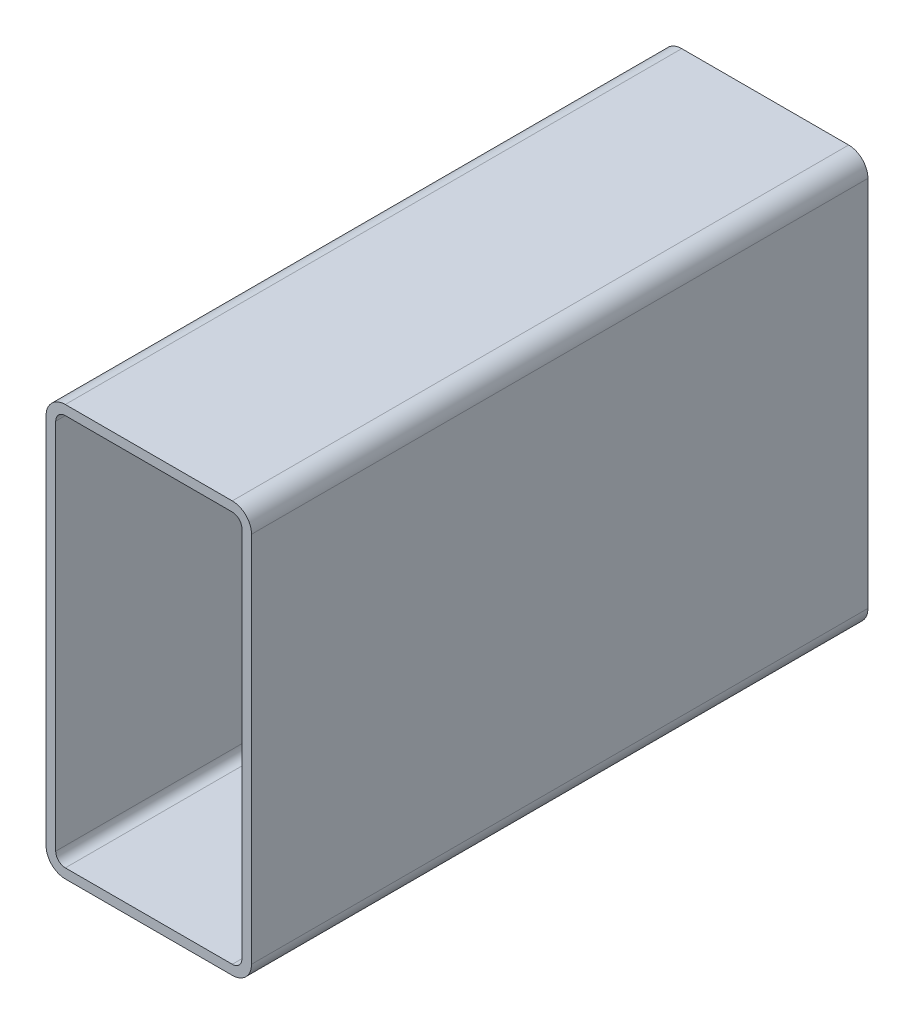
SolidWorks part; units mm, degrees
ref_plane "Front Plane" through (0, 0, 0) normal (0, 0, 1) x (1, 0, 0)
ref_plane "Top Plane" through (0, 0, 0) normal (0, 1, 0) x (1, 0, 0)
ref_plane "Right Plane" through (0, 0, 0) normal (1, 0, 0) x (0, 0, -1)
sketch "Sketch1" plane through (0, 0, 0) normal (0, 0, 1) x (1, 0, 0)
  point P0 (0, 0)
sketch_block_instance "HSS8x4x0.1875-1"
sketch_block "HSS8x4x0.1875"
extrude "Boss-Extrude1" add sketch "Sketch1" along normal blind 304.8
